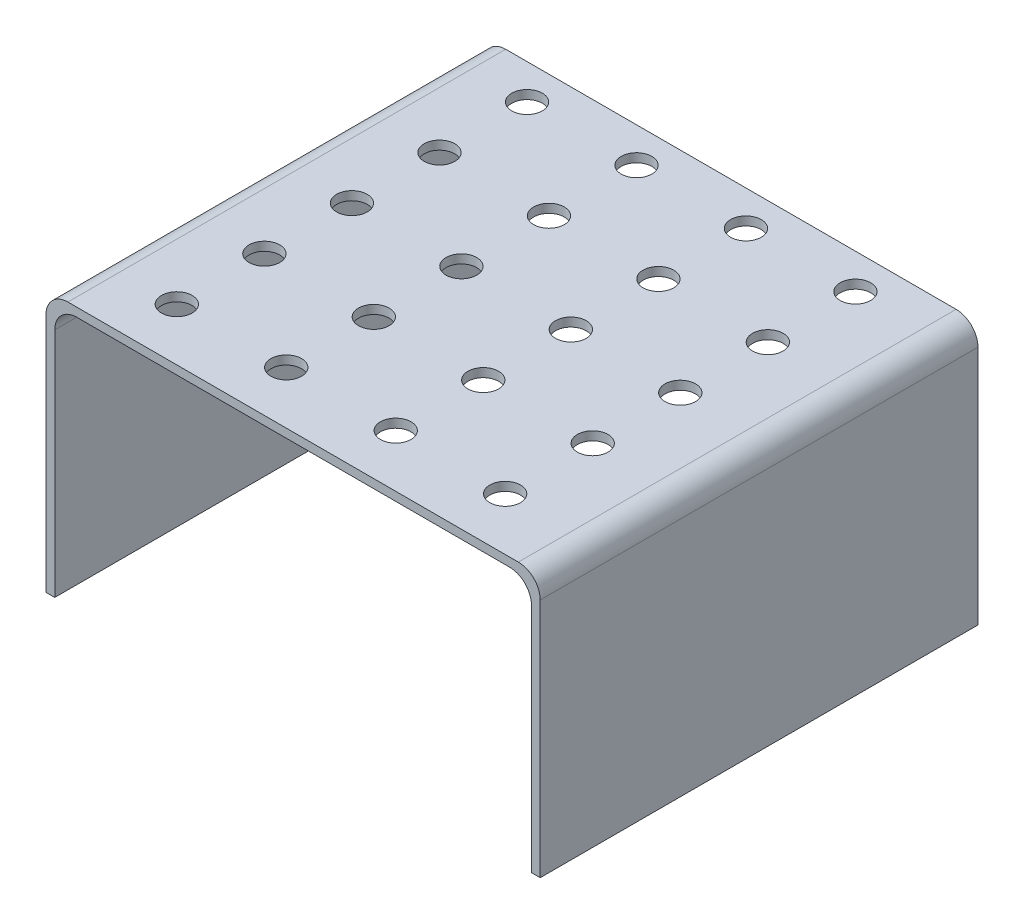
SolidWorks part; units mm, degrees
ref_plane "Plan de face" through (0, 0, 0) normal (0, 0, 1) x (1, 0, 0)
ref_plane "Plan de dessus" through (0, 0, 0) normal (0, 1, 0) x (1, 0, 0)
ref_plane "Plan de droite" through (0, 0, 0) normal (1, 0, 0) x (0, 0, -1)
sketch "Esquisse2" plane through (0, 0, 0) normal (0, 0, 1) x (1, 0, 0)
  line L0 (-42.3555, -30.4024) -> (-40.3555, -30.4024)
  line L1 (-40.3555, -30.4024) -> (-40.3555, 27.5386)
  line L2 (-40.3555, 27.5386) -> (68.5226, 27.5386)
  line L3 (68.5226, 27.5386) -> (68.5226, -30.4024)
  line L4 (68.5226, -30.4024) -> (70.5226, -30.4024)
  line L5 (70.5226, -30.4024) -> (70.5226, 29.5386)
  line L6 (70.5226, 29.5386) -> (-42.3555, 29.5386)
  line L7 (-42.3555, 29.5386) -> (-42.3555, -30.4024)
  dimension "D1" = 2
  dimension "D2" = 2
extrude "Extrusion1" add sketch "Esquisse2" along normal blind 100
fillet "Congé1" radius 5 4 edges at (-42.3555, 29.5386, 50) (70.5226, 29.5386, 50) (68.5226, 27.5386, 50) (-40.3555, 27.5386, 50)
sketch "Esquisse3" plane through (0, 29.5386, 0) normal (0, 1, 0) x (-1, 0, 0)
  line L0 (-65.5226, 100) -> (37.3555, 100) construction
  line L1 (-70.5226, 0) -> (-70.5226, 100) construction
  circle A0 centre (-50.5226, 88) radius 3.5
  dimension "D1" = 7
  dimension "D3" = 20
  dimension "D2" = 12
extrude "Enlèv. mat.-Extru.1" cut sketch "Esquisse3" against normal through all
pattern_linear "Répétition linéaire1" count 4 spacing 25 along (-1, 0, 0) count 5 spacing 20 along (0, 0, -1) of "Enlèv. mat.-Extru.1"
